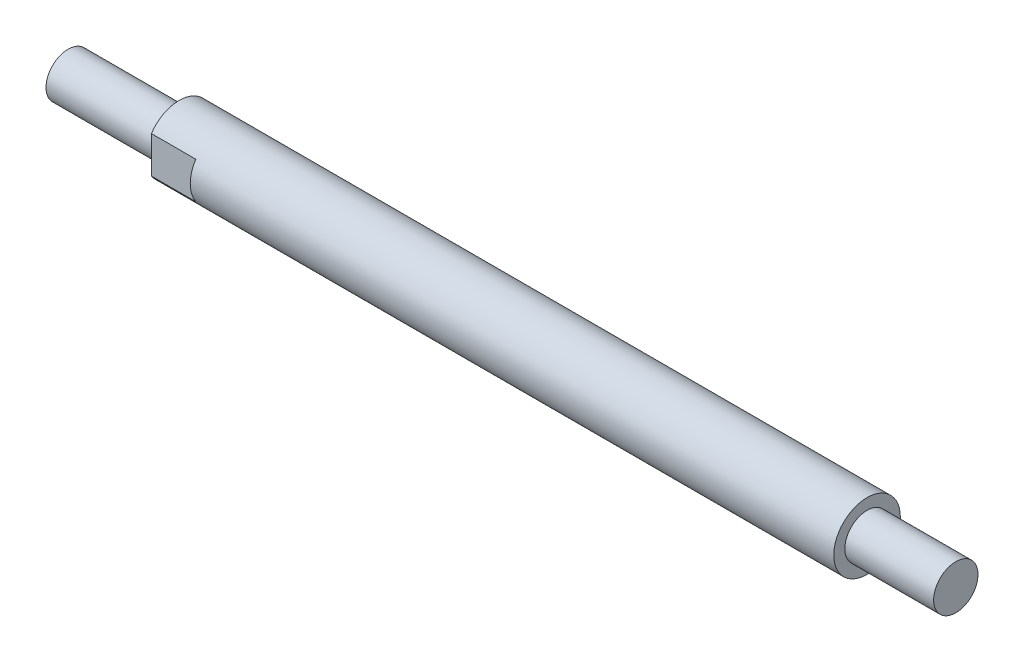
SolidWorks part; units mm, degrees
ref_plane "Front" through (0, 0, 0) normal (0, 0, 1) x (1, 0, 0)
ref_plane "Top" through (0, 0, 0) normal (0, 1, 0) x (1, 0, 0)
ref_plane "Right" through (0, 0, 0) normal (1, 0, 0) x (0, 0, -1)
sketch "Sketch1" plane through (0, 0, 0) normal (1, 0, 0) x (0, 0, -1)
  circle A0 centre (0, 0) radius 4.7625
  dimension "D1" = 9.525
extrude "Base-Extrude" add sketch "Sketch1" along normal blind 114.3
sketch "Sketch2" plane through (114.3, 0, 0) normal (1, 0, 0) x (0, 0, -1)
  circle A0 centre (0, 0) radius 3.175
  dimension "D1" = 6.35
extrude "Boss-Extrude1" add sketch "Sketch2" along normal blind 12.7
sketch "Sketch3" plane through (0, 0, 0) normal (-1, 0, 0) x (0, 0, 1)
  circle A0 centre (0, 0) radius 3.175
  circle A2 centre (0, 0) radius 4.7625
  circle A3 centre (0, 0) radius 4.7625
  dimension "D1" = 6.35
  dimension "D2" = 0
extrude "Cut-Extrude1" cut sketch "Sketch3" against normal blind 15.875
sketch "Sketch4" plane through (15.875, 0, 0) normal (-1, 0, 0) x (0, 0, 1)
  line L1 (3.9687, 2.6326) -> (3.9687, -2.6326)
  line L3 (-3.9688, -2.6326) -> (-3.9687, 2.6326)
  line L4 (0, 4.7625) -> (0, 0) construction
  arc A1 (3.9687, -2.6326) -> (3.9687, 2.6326) centre (0, 0) ccw
  circle A2 centre (0, 0) radius 4.7625
  arc A3 (-3.9687, 2.6326) -> (-3.9688, -2.6326) centre (0, 0) ccw
  dimension "D1" = 7.9375
  dimension "D2" = 0
extrude "Cut-Extrude2" cut sketch "Sketch4" against normal blind 6.35
